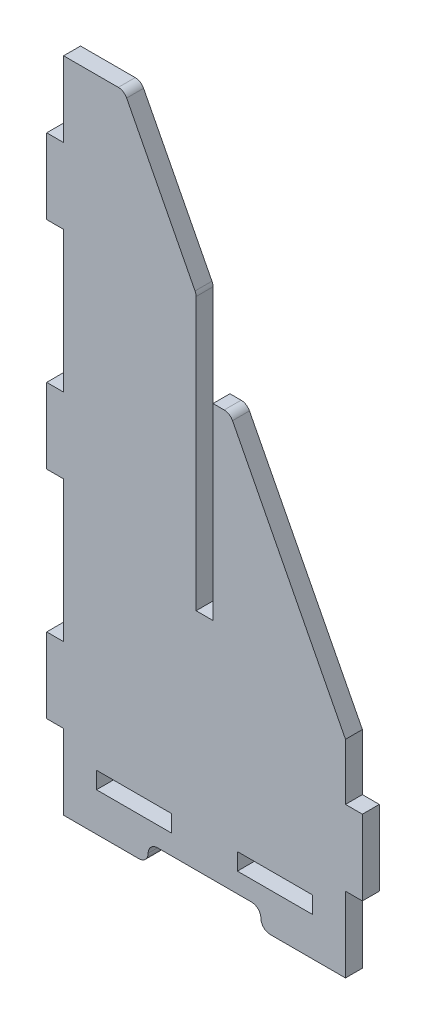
SolidWorks part; units mm, degrees
ref_plane "Piano frontale" through (0, 0, 0) normal (0, 0, 1) x (1, 0, 0)
ref_plane "Piano superiore" through (0, 0, 0) normal (0, 1, 0) x (1, 0, 0)
ref_plane "Piano destro" through (0, 0, 0) normal (1, 0, 0) x (0, 0, -1)
sketch "Schizzo1" plane through (0, 0, 0) normal (0, 0, 1) x (1, 0, 0)
  line L0 (150, -350) -> (150, -130)
  line L1 (-150, 350) -> (150, 350) construction
  line L2 (-150, 350) -> (-150, -350)
  line L3 (-150, -350) -> (150, -350)
  line L4 (150, 350) -> (150, -350) construction
  line L5 (-150, 350) -> (150, -350) construction
  line L6 (-150, -350) -> (150, 350) construction
  line L7 (-150, 350) -> (-85.6892, 350)
  line L8 (150, -130) -> (27, 109)
  line L9 (27, 109) -> (-9, 109)
  line L10 (-9, 109) -> (-9, 201.0175)
  line L11 (-9, 201.0175) -> (-85.6892, 350)
  point P0 (0, 0)
  dimension "D1" = 300
  dimension "D2" = 700
  dimension "D3" = 220
  dimension "D4" = 36
  dimension "D5" = 239
  dimension "D6" = 123
extrude "Estrusione-Estrusione1" add sketch "Schizzo1" along normal blind 18
sketch "Schizzo2" plane through (0, 0, 18) normal (0, 0, 1) x (1, 0, 0)
  line L0 (-150, -350) -> (150, -350) construction
  line L1 (-60, -330) -> (60, -330)
  line L2 (-60, -330) -> (-60, -350)
  line L3 (-60, -350) -> (60, -350)
  line L4 (60, -330) -> (60, -350)
  line L5 (-60, -330) -> (60, -350) construction
  line L6 (-60, -350) -> (60, -330) construction
  point P0 (0, -340)
  point P7 (0, 0)
  dimension "D1" = 20
  dimension "D2" = 120
extrude "Taglio-Estrusione1" cut sketch "Schizzo2" against normal blind 18
fillet "Raccordo1" radius 10 4 edges at (60, -330, 9) (60, -350, 9) (-60, -350, 9) (-60, -330, 9)
sketch "Schizzo3" plane through (0, 0, 18) normal (0, 0, 1) x (1, 0, 0)
  line L0 (150, -350) -> (150, -130) construction
  line L1 (150, -190) -> (168, -190)
  line L2 (150, -190) -> (150, -270)
  line L3 (150, -270) -> (168, -270)
  line L4 (168, -190) -> (168, -270)
  line L5 (0, 0) -> (0, -357.883) construction
  line L6 (-168, -190) -> (-168, -270)
  line L7 (-150, -270) -> (-168, -270)
  line L8 (-150, -190) -> (-150, -270)
  line L9 (-150, -190) -> (-168, -190)
  dimension "D1" = 80
  dimension "D2" = 80
  dimension "D3" = 18
extrude "Estrusione-Estrusione2" add sketch "Schizzo3" against normal blind 18
sketch "Schizzo4" plane through (0, 0, 0) normal (0, 0, -1) x (-1, 0, 0)
  line L0 (-150, -300) -> (150, -300) construction
  line L1 (-150, -350) -> (-150, -270) construction
  line L2 (150, -270) -> (150, -350) construction
  line L3 (-70, -350) -> (-150, -350) construction
  line L4 (0, 0) -> (0, -330) construction
  line L5 (-115, -291) -> (-35, -291)
  line L6 (-115, -291) -> (-115, -309)
  line L7 (-115, -309) -> (-35, -309)
  line L8 (-35, -291) -> (-35, -309)
  line L9 (-115, -291) -> (-35, -309) construction
  line L10 (-115, -309) -> (-35, -291) construction
  line L11 (-50, -330) -> (50, -330) construction
  line L12 (115, -309) -> (35, -291) construction
  line L13 (115, -291) -> (35, -309) construction
  line L14 (35, -291) -> (35, -309)
  line L15 (115, -309) -> (35, -309)
  line L16 (115, -291) -> (115, -309)
  line L17 (115, -291) -> (35, -291)
  point P8 (-75, -300)
  point P22 (75, -300)
  dimension "D1" = 50
  dimension "D2" = 80
  dimension "D3" = 18
  dimension "D4" = 35
extrude "Taglio-Estrusione2" cut sketch "Schizzo4" against normal blind 18
sketch "Schizzo5" plane through (0, 0, 0) normal (0, 0, -1) x (-1, 0, 0)
  line L0 (0, 0) -> (150, 0) construction
  line L1 (150, 350) -> (150, -190) construction
  line L2 (168, -190) -> (168, -270) construction
  line L3 (168, 40) -> (150, 40)
  line L4 (168, 40) -> (168, -40)
  line L5 (168, -40) -> (150, -40)
  line L6 (150, 40) -> (150, -40)
  line L7 (168, 40) -> (150, -40) construction
  line L8 (168, -40) -> (150, 40) construction
  line L9 (150, -190) -> (168, -190) construction
  line L10 (168, -270) -> (150, -270) construction
  line L11 (168, -270) -> (150, -270) construction
  line L12 (168, -190) -> (168, -270) construction
  line L13 (150, -190) -> (150, -270) construction
  line L14 (150, 190) -> (150, 270)
  line L15 (168, 190) -> (168, 270)
  line L16 (168, 270) -> (150, 270)
  line L17 (168, 190) -> (150, 190)
  point P5 (159, 0)
extrude "Estrusione-Estrusione3" add sketch "Schizzo5" against normal blind 18
fillet "Raccordo2" radius 10 3 edges at (-85.6892, 350, 9) (-9, 201.0175, 9) (27, 109, 9)
sketch "Schizzo7" plane through (0, 0, 18) normal (0, 0, 1) x (1, 0, 0)
  line L1 (-9, 109) -> (9, 109)
  line L2 (-9, 109) -> (-9, -91)
  line L3 (-9, -91) -> (9, -91)
  line L4 (9, 109) -> (9, -91)
  dimension "D1" = 18
  dimension "D2" = 200
extrude "Taglio-Estrusione4" cut sketch "Schizzo7" against normal blind 18
